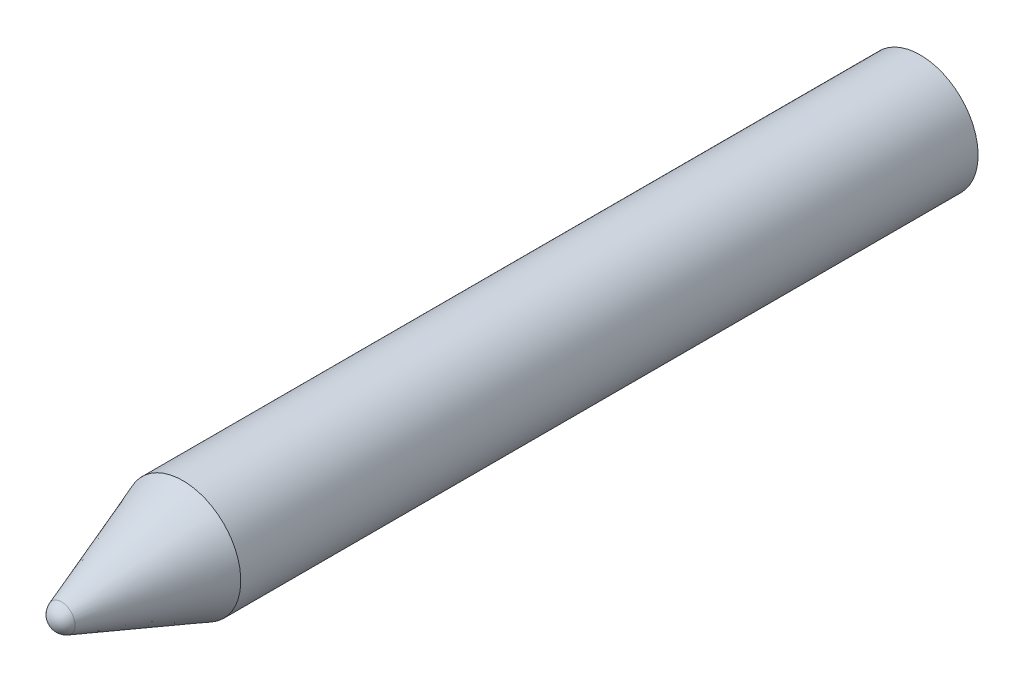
SolidWorks part; units mm, degrees
ref_plane "Ebene vorne" through (0, 0, 0) normal (0, 0, 1) x (1, 0, 0)
ref_plane "Ebene oben" through (0, 0, 0) normal (0, 1, 0) x (1, 0, 0)
ref_plane "Ebene rechts" through (0, 0, 0) normal (1, 0, 0) x (0, 0, -1)
sketch "Skizze1" plane through (0, 0, 0) normal (0, 1, 0) x (1, 0, 0)
  line L0 (0, 93.0629) -> (0, -65.1278) construction
  line L1 (-1.8789, -50.5517) -> (-8, -33.7737)
  line L2 (-8, -33.7737) -> (-8, 68.1337)
  line L3 (0, -51.8663) -> (0, 68.1337)
  line L5 (-8, 68.1337) -> (0, 68.1337)
  arc A0 (0, -51.8663) -> (-1.8789, -50.5517) centre (0, -49.8663) cw
  point P10 (0, -55.7017)
  dimension "D2" = 2
  dimension "D1" = 16
  dimension "D3" = 120
revolve "Rotation1" add sketch "Skizze1" angle 360 about L0
